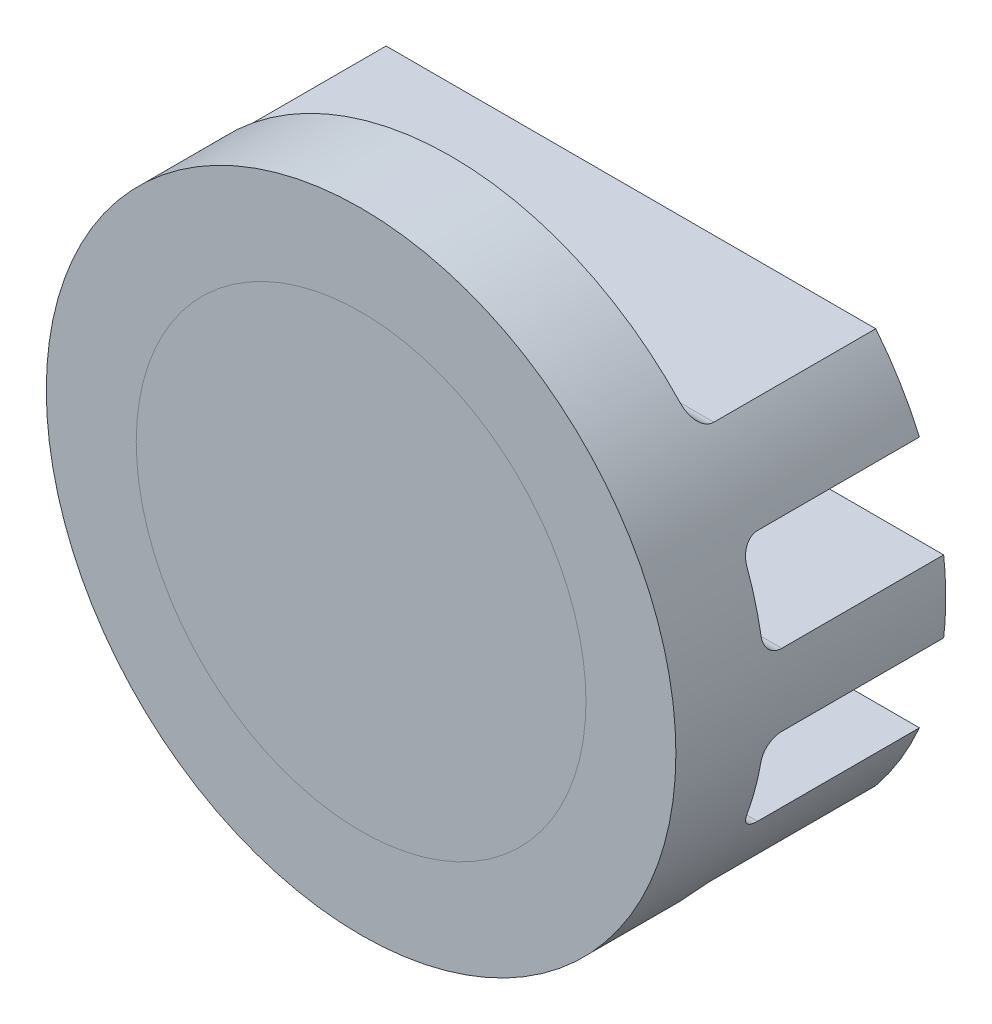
SolidWorks part; units mm, degrees
ref_plane "Front" through (0, 0, 0) normal (0, 0, 1) x (1, 0, 0)
ref_plane "Top" through (0, 0, 0) normal (0, 1, 0) x (1, 0, 0)
ref_plane "Right" through (0, 0, 0) normal (1, 0, 0) x (0, 0, -1)
sketch "Sketch1" plane through (0, 0, 0) normal (0, 0, 1) x (1, 0, 0)
  line L0 (0, 0) -> (53.3826, 0) construction
  line L5 (0, 46.8286) -> (0, 0) construction
  circle A0 centre (0, 0) radius 35
  dimension "D1" = 70
extrude "Base-Extrude" add sketch "Sketch1" along normal blind 10
sketch "Sketch6" plane through (0, 0, 0) normal (0, 0, -1) x (-1, 0, 0)
  line L0 (0, 0) -> (47.1642, 0) construction
  line L1 (0, 0) -> (0, 42.4167) construction
  line L3 (-43, -4) -> (43, -4)
  line L4 (-43, -4) -> (-43, 4)
  line L5 (-43, 4) -> (43, 4)
  line L6 (43, -4) -> (43, 4)
  dimension "D1" = 86
  dimension "D2" = 43
  dimension "D3" = 8
  dimension "D4" = 4
extrude "Extrude1" add sketch "Sketch6" along normal blind 20
pattern_linear "LPattern2" count 2 spacing 18 along (0, 1, 0) of "Extrude1"
mirror "Mirror1" about plane through (0, 0, 0) normal (0, 1, 0) of "LPattern2"
sketch "Sketch7" plane through (0, 0, 10) normal (0, 0, 1) x (1, 0, 0)
  circle A1 centre (0, 0) radius 35
  circle A2 centre (0, 0) radius 35
  dimension "D1" = 0
extrude "Cut-Extrude2" cut sketch "Sketch7" against normal through all flip side to cut
fillet "Fillet3" radius 2 6 edges at (0, 14, 0) (0, 22, 0) (0, -14, 0) (0, -22, 0) (0, -4, 0) (0, 4, 0)
sketch "Sketch9" plane through (0, 0, 10) normal (0, 0, 1) x (1, 0, 0)
  circle A0 centre (0, 0) radius 25
  dimension "D1" = 50
sketch "Sketch10" plane through (0, 0, -20) normal (0, 0, -1) x (-1, 0, 0)
  line L0 (0, 4) -> (0, -4)
  line L1 (34.7707, 4) -> (-34.7707, 4) construction
  line L2 (-34.7707, -4) -> (34.7707, -4) construction
sketch "Sketch11" plane through (0, 0, -20) normal (0, 0, -1) x (-1, 0, 0)
  line L0 (-35, 0) -> (35, 0)
  arc A0 (-34.7707, 4) -> (-34.7707, -4) centre (0, 0) ccw construction
  arc A1 (34.7707, -4) -> (34.7707, 4) centre (0, 0) ccw construction
equation "\"D4@Sketch6\" = \"D3@Sketch6\"/2"
